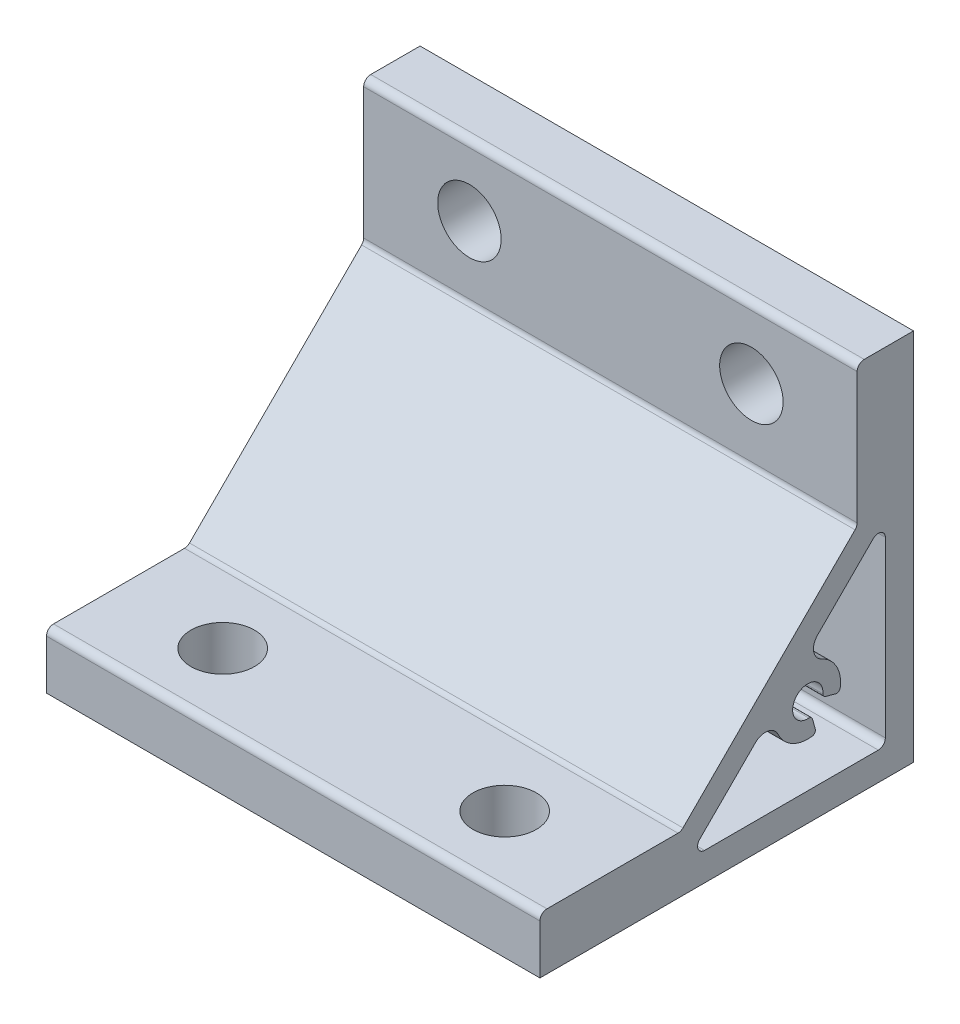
SolidWorks part; units mm, degrees
ref_plane "正面" through (0, 0, 0) normal (0, 0, 1) x (1, 0, 0)
ref_plane "平面" through (0, 0, 0) normal (0, 1, 0) x (1, 0, 0)
ref_plane "右側面" through (0, 0, 0) normal (1, 0, 0) x (0, 0, -1)
sketch "ｽｹｯﾁ1" plane through (0, 0, 0) normal (1, 0, 0) x (0, 0, -1)
  line L0 (-53, 0) -> (0, 0)
  line L1 (-52, 8) -> (-33.4142, 8)
  line L2 (-53, 0) -> (-53, 7)
  line L3 (0, 0) -> (0, 53)
  line L4 (-8.2929, 32.7071) -> (-32.7071, 8.2929)
  line L5 (-5.7071, 30.3431) -> (-13.6074, 22.4428)
  line L6 (-29.636, 4) -> (-5, 4)
  line L7 (-22.4428, 13.6074) -> (-30.3431, 5.7071)
  line L8 (-13.9337, 11.0206) -> (-14.3264, 12.4863)
  line L9 (-11.0206, 13.9337) -> (-12.4863, 14.3264)
  line L10 (-4, 5) -> (-4, 29.636)
  line L11 (-8, 33.4142) -> (-8, 52)
  line L12 (-7, 53) -> (0, 53)
  arc A0 (-52, 8) -> (-53, 7) centre (-52, 7) ccw
  arc A1 (-10.3962, 14.3464) -> (-13.0373, 19.2155) centre (-15, 15) ccw
  arc A2 (-11.0206, 13.9337) -> (-10.3962, 14.3464) centre (-10.8912, 14.4167) ccw
  arc A3 (-12.8556, 14.8454) -> (-14.8454, 12.8556) centre (-15, 15) ccw
  arc A4 (-19.2155, 13.0373) -> (-22.4428, 13.6074) centre (-21.0286, 12.1932) ccw
  arc A5 (-30.3431, 5.7071) -> (-29.636, 4) centre (-29.636, 5) ccw
  arc A6 (-33.4142, 8) -> (-32.7071, 8.2929) centre (-33.4142, 9) ccw
  arc A7 (-19.2155, 13.0373) -> (-14.3464, 10.3962) centre (-15, 15) ccw
  arc A8 (-14.3464, 10.3962) -> (-13.9337, 11.0206) centre (-14.4167, 10.8912) ccw
  arc A9 (-14.3264, 12.4863) -> (-14.8454, 12.8556) centre (-14.8094, 12.3569) ccw
  arc A10 (-12.8556, 14.8454) -> (-12.4863, 14.3264) centre (-12.3569, 14.8094) ccw
  arc A11 (-13.6074, 22.4428) -> (-13.0373, 19.2155) centre (-12.1932, 21.0286) ccw
  arc A12 (-5, 4) -> (-4, 5) centre (-5, 5) ccw
  arc A13 (-4, 29.636) -> (-5.7071, 30.3431) centre (-5, 29.636) ccw
  arc A14 (-8.2929, 32.7071) -> (-8, 33.4142) centre (-9, 33.4142) ccw
  arc A15 (-7, 53) -> (-8, 52) centre (-7, 52) ccw
extrude "押し出し1" add sketch "ｽｹｯﾁ1" along normal mid plane 70
hole_wizard "Ø9.0 (9) 直径の穴1" positions "3Dｽｹｯﾁ1" profile "ｽｹｯﾁ3" hole size "Ø9.0" standard "JIS"
sketch3d "3Dｽｹｯﾁ1"
  line L0 (-35, 52, 8) -> (-35, 33.4142, 8) construction
  line L1 (35, 52, 8) -> (-35, 52, 8) construction
  line L2 (-35, 8, 33.4142) -> (-35, 8, 52) construction
  line L3 (35, 8, 52) -> (-35, 8, 52) construction
  point P0 (-20, 8, 43)
  point P2 (20, 8, 43)
  point P4 (-20, 43, 8)
  point P6 (20, 43, 8)
  dimension "D1" = 15
  dimension "D2" = 40
  dimension "D3" = 9
  dimension "D4" = 15
  dimension "D5" = 40
  dimension "D6" = 9
sketch "ｽｹｯﾁ3" plane through (-20, 8, 43) normal (1, 0, 0) x (0, 0, 1)
  line L0 (0, 0) -> (0, 8)
  line L1 (0, 8) -> (4.5, 8)
  line L2 (4.5, 8) -> (4.5, 0)
  line L5 (4.5, 0) -> (0, 0)
  line L11 (0, -6.35) -> (0, 107.95) construction
  dimension "通し穴の直径" = 9
  dimension "通し穴の深さ" = 8
